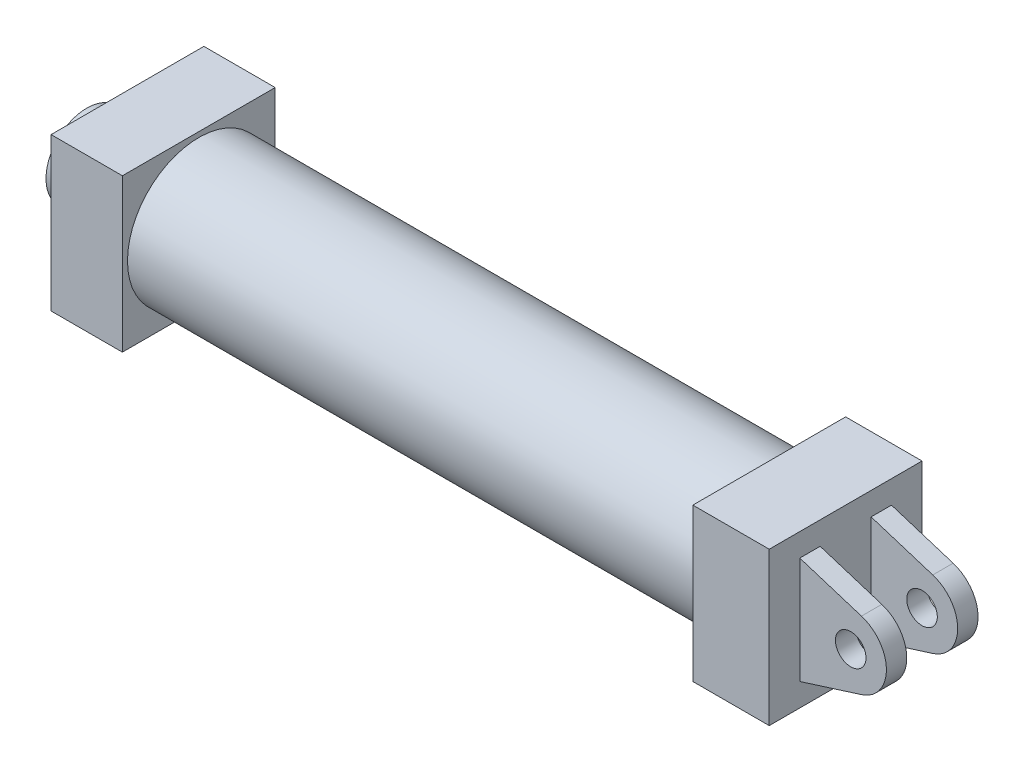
SolidWorks part; units mm, degrees
ref_plane "front" through (0, 0, 0) normal (0, 0, 1) x (1, 0, 0)
ref_plane "top" through (0, 0, 0) normal (0, 1, 0) x (1, 0, 0)
ref_plane "side" through (0, 0, 0) normal (1, 0, 0) x (0, 0, -1)
sketch "Sketch1" plane through (0, 0, 0) normal (1, 0, 0) x (0, 0, -1)
  line L0 (-47.625, 47.625) -> (47.625, 47.625)
  line L1 (-47.625, 47.625) -> (-47.625, -47.625)
  line L2 (47.625, -47.625) -> (-47.625, -47.625)
  line L3 (47.625, -47.625) -> (47.625, 47.625)
  line L4 (0, 47.625) -> (0, 0) construction
  line L5 (47.625, 0) -> (0, 0) construction
  dimension "D1" = 95.25
extrude "Base-Extrude" add sketch "Sketch1" against normal blind 47.625
sketch "Sketch2" plane through (-47.625, 0, 0) normal (-1, 0, 0) x (0, 0, 1)
  circle A0 centre (0, 0) radius 44.45
  dimension "D1" = 88.9
extrude "Boss-Extrude1" add sketch "Sketch2" along normal blind 355.6
sketch "Sketch3" plane through (-403.225, 0, 0) normal (-1, 0, 0) x (0, 0, 1)
  line L4 (47.625, -47.625) -> (47.625, 47.625)
  line L5 (47.625, 47.625) -> (-47.625, 47.625)
  line L6 (-47.625, 47.625) -> (-47.625, -47.625)
  line L7 (-47.625, -47.625) -> (47.625, -47.625)
  line L8 (47.625, -47.625) -> (47.625, 47.625)
  line L9 (47.625, 47.625) -> (-47.625, 47.625)
  line L10 (-47.625, 47.625) -> (-47.625, -47.625)
  line L11 (-47.625, -47.625) -> (47.625, -47.625)
  dimension "D1" = 0
extrude "Boss-Extrude2" add sketch "Sketch3" along normal blind 44.45
sketch "Sketch4" plane through (-447.675, 0, 0) normal (-1, 0, 0) x (0, 0, 1)
  circle A0 centre (0, 0) radius 25.4
  dimension "D1" = 50.8
extrude "Boss-Extrude3" add sketch "Sketch4" along normal blind 25.4
sketch "Sketch5" plane through (-473.075, 0, 0) normal (-1, 0, 0) x (0, 0, 1)
  circle A0 centre (0, 0) radius 17.4625
  dimension "D1" = 34.925
extrude "Cut-Extrude1" cut sketch "Sketch5" against normal up to surface (425.45 mm away)
sketch "Sketch6" plane through (0, 0, 0) normal (0, 0, 1) x (1, 0, 0)
  line L0 (0, 0) -> (31.75, 0) construction
  line L1 (-403.225, 0) -> (-47.625, 0) construction
  line L2 (38.4332, 21.1964) -> (0, 33.3143)
  line L3 (0, 47.625) -> (0, -47.625) construction
  line L4 (38.4332, -21.1964) -> (0, -33.3143)
  line L5 (0, 33.3143) -> (0, -33.3143)
  arc A0 (38.4332, -21.1964) -> (38.4332, 21.1964) centre (31.75, 0) ccw
  circle A1 centre (31.75, 0) radius 9.525
  dimension "D3" = 19.05
  dimension "D4" = 22.225
  dimension "D1" = 35
  dimension "D2" = 31.75
extrude "Boss-Extrude4" add sketch "Sketch6" along normal mid plane 57.15
sketch "Sketch7" plane through (0, 47.625, 0) normal (0, 1, 0) x (-1, 0, 0)
  line L0 (0, 0) -> (-73.3102, 0) construction
  line L1 (403.225, 0) -> (47.625, 0) construction
  line L2 (-53.975, 15.875) -> (-53.975, -15.875)
  line L3 (-53.975, -15.875) -> (0, -15.875)
  line L4 (0, 47.625) -> (0, -47.625) construction
  line L5 (-53.975, 15.875) -> (0, 15.875)
  line L6 (0, -15.875) -> (0, 15.875)
  line L7 (-53.975, 28.575) -> (-53.975, -28.575) construction
  point P8 (-53.975, 0)
  point P12 (0, 0)
  dimension "D1" = 31.75
extrude "Cut-Extrude2" cut sketch "Sketch7" against normal through all
